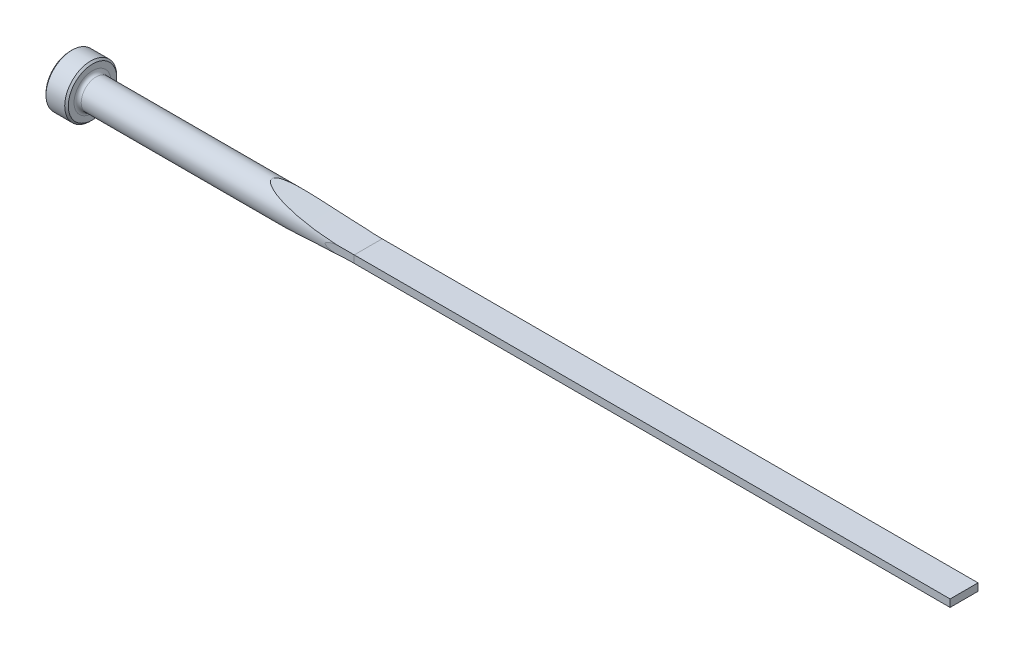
SolidWorks part; units mm, degrees
ref_plane "Front Plane" through (0, 0, 0) normal (0, 0, 1) x (1, 0, 0)
ref_plane "Top Plane" through (0, 0, 0) normal (0, 1, 0) x (1, 0, 0)
ref_plane "Right Plane" through (0, 0, 0) normal (1, 0, 0) x (0, 0, -1)
sketch "Sketch1" plane through (0, 0, 0) normal (0, 0, 1) x (1, 0, 0)
  line L0 (0, 0) -> (175.5286, 0) construction
  line L1 (0, 0) -> (0, 5.5499)
  line L2 (0, 5.5499) -> (4.7498, 5.5499)
  line L3 (4.7498, 5.5499) -> (4.7498, 3.175)
  line L4 (4.7498, 3.175) -> (190.5, 3.175)
  line L5 (190.5, 3.175) -> (190.5, 0)
  line L6 (190.5, 0) -> (0, 0)
  dimension "D1" = 190.5
  dimension "D2" = 11.0998
  dimension "D3" = 6.35
  dimension "D4" = 4.7498
revolve "Revolve1" add sketch "Sketch1" angle 360 about L0
sketch "Sketch2" plane through (0, 0, 0) normal (0, 0, 1) x (1, 0, 0)
  line L0 (190.5, 3.175) -> (190.5, 0.7874)
  line L1 (190.5, -3.175) -> (190.5, 3.175) construction
  line L2 (190.5, 0.7874) -> (63.5, 0.7874)
  line L3 (190.5, 3.175) -> (4.7498, 3.175) construction
  line L4 (43.035, 3.175) -> (190.5, 3.175)
  line L5 (166.0833, 0) -> (153.1705, 0) construction
  arc A0 (63.5, 0.7874) -> (43.035, 3.175) centre (63.5, 89.6874) cw
  dimension "D1" = 88.9
  dimension "D3" = 127
  dimension "D2" = 1.5748
  dimension "D4" = 20.465
extrude "Cut-Extrude1" cut sketch "Sketch2" against normal through all both and the other way through all
mirror "Mirror1" about plane through (0, 0, 0) normal (0, 1, 0) of "Cut-Extrude1"
sketch "Sketch3" plane through (0, 0, 0) normal (0, 1, 0) x (1, 0, 0)
  line L0 (190.5, 3.175) -> (190.5, 2.9718)
  line L1 (190.5, 3.0758) -> (190.5, -3.0758) construction
  line L2 (190.5, 2.9718) -> (63.5, 2.9718)
  line L3 (190.5, 3.175) -> (4.7498, 3.175) construction
  line L4 (57.4927, 3.175) -> (190.5, 3.175)
  line L5 (163.4716, 0) -> (166.2513, 0) construction
  line L6 (63.5, 3.0758) -> (63.5, -3.0758) construction
  arc A0 (63.5, 2.9718) -> (57.4927, 3.175) centre (63.5, 91.8718) cw
  dimension "D2" = 88.9
  dimension "D1" = 5.9436
extrude "Cut-Extrude2" cut sketch "Sketch3" against normal through all both and the other way through all
mirror "Mirror2" about plane through (0, 0, 0) normal (0, 0, 1) of "Cut-Extrude2"
fillet "Fillet1" radius 0.762 1 edges at (4.7498, 0, 3.175)
chamfer "Chamfer1" distance 0.381 angle 45 2 edges at (0, 0, 5.5499) (4.7498, 0, 5.5499)
